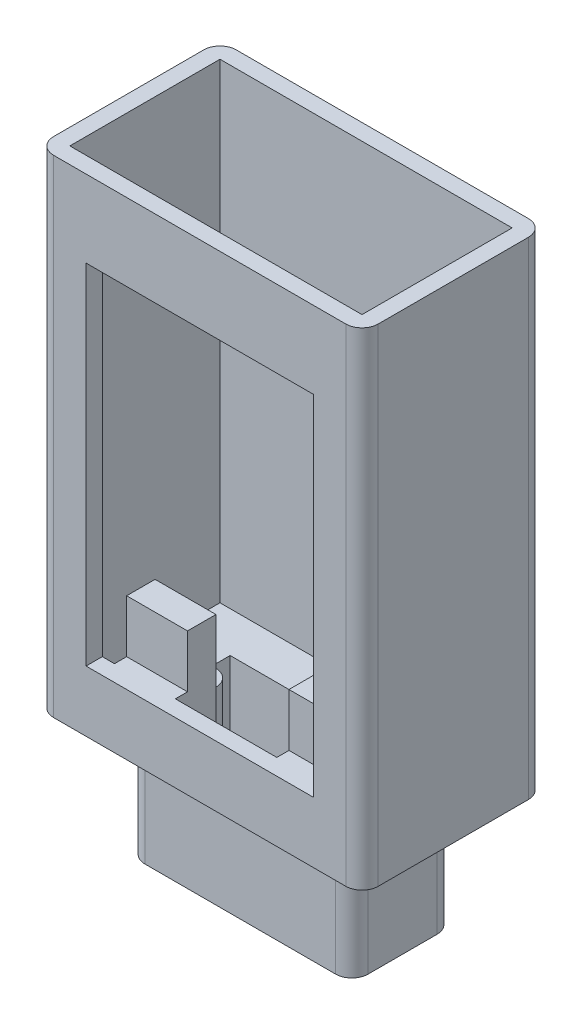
SolidWorks part; units mm, degrees
ref_plane "Ebene vorne" through (0, 0, 0) normal (0, 0, 1) x (1, 0, 0)
ref_plane "Ebene oben" through (0, 0, 0) normal (0, 1, 0) x (1, 0, 0)
ref_plane "Ebene rechts" through (0, 0, 0) normal (1, 0, 0) x (0, 0, -1)
sketch "Skizze1" plane through (0, 0, 0) normal (0, 1, 0) x (1, 0, 0)
  line L1 (40, -22.5) -> (-40, -22.5)
  line L2 (40, -22.5) -> (40, 22.5)
  line L3 (40, 22.5) -> (-40, 22.5)
  line L4 (-40, -22.5) -> (-40, 22.5)
  line L5 (40, -22.5) -> (-40, 22.5) construction
  line L6 (40, 22.5) -> (-40, -22.5) construction
  point P0 (0, 0)
  dimension "D1" = 45
  dimension "D2" = 80
extrude "Aufsatz-Linear austragen1" add sketch "Skizze1" along normal blind 120
sketch "Skizze6" plane through (0, 0, 0) normal (0, 0, 1) x (1, 0, 0)
  line L1 (-40, 120) -> (294.1001, 120)
  line L2 (-40, 120) -> (-40, 162.8242)
  line L3 (-40, 162.8242) -> (294.1001, 162.8242)
  line L4 (294.1001, 120) -> (294.1001, 162.8242)
extrude "Aufsatz-Linear austragen4" [suppressed] add sketch "Skizze6" along normal mid plane 45
sketch "Skizze7" plane through (0, 0, 0) normal (0, -1, 0) x (1, 0, 0)
  line L1 (27.5, -12.5) -> (-27.5, -12.5)
  line L2 (27.5, -12.5) -> (27.5, 12.5)
  line L3 (27.5, 12.5) -> (-27.5, 12.5)
  line L4 (-27.5, -12.5) -> (-27.5, 12.5)
  line L5 (27.5, -12.5) -> (-27.5, 12.5) construction
  line L6 (27.5, 12.5) -> (-27.5, -12.5) construction
  point P0 (0, 0)
  dimension "D1" = 25
  dimension "D2" = 55
extrude "Aufsatz-Linear austragen5" add sketch "Skizze7" along normal blind 30
fillet "Verrundung1" radius 4 4 edges at (27.5, -15, -12.5) (27.5, -15, 12.5) (-27.5, -15, -12.5) (-27.5, -15, 12.5)
shell "Wandung2" thickness 4
sketch "Skizze8" plane through (0, -30, 0) normal (0, -1, 0) x (1, 0, 0)
  line L0 (0, 0) -> (0, 6.0785) construction
  circle A0 centre (-22.5, 0) radius 4
  circle A1 centre (22.5, 0) radius 4
  dimension "D1" = 8
  dimension "D2" = 45
extrude "Aufsatz-Linear austragen6" add sketch "Skizze8" against normal up to surface (34 mm away)
sketch "Skizze9" plane through (0, -30, 0) normal (0, -1, 0) x (1, 0, 0)
  circle A0 centre (-22.5, 0) radius 1.5
  circle A1 centre (22.5, 0) radius 1.5
  dimension "D1" = 3
extrude "Schnitt-Linear austragen1" cut sketch "Skizze9" against normal through all
sketch "Skizze10" plane through (0, 0, 0) normal (0, 0, 1) x (1, 0, 0)
  line L0 (-40, 0) -> (40, 0) construction
  line L5 (-28, 15) -> (28, 15)
  line L6 (-28, 15) -> (-28, 101)
  line L7 (-28, 101) -> (28, 101)
  line L8 (28, 15) -> (28, 101)
  line L9 (-28, 15) -> (28, 101) construction
  line L10 (-28, 101) -> (28, 15) construction
  point P0 (0, 58)
  point P4 (79.6056, 3.9849)
  dimension "D1" = 56
  dimension "D2" = 86
  dimension "D3" = 15
extrude "Schnitt-Linear austragen2" cut sketch "Skizze10" along normal through all
sketch "Skizze11" plane through (0, 4, 0) normal (0, 1, 0) x (1, 0, 0)
  line L0 (23.5, -8.5) -> (-23.5, -8.5) construction
  line L1 (-25, -18.5) -> (-10, -18.5)
  line L2 (-25, -18.5) -> (-25, -8.5)
  line L3 (-25, -8.5) -> (-10, -8.5)
  line L4 (-10, -18.5) -> (-10, -8.5)
  line L5 (15, -18.5) -> (25, -18.5)
  line L6 (15, -18.5) -> (15, -8.5)
  line L7 (15, -8.5) -> (25, -8.5)
  line L8 (25, -18.5) -> (25, -8.5)
  point P8 (0, 0)
  dimension "D1" = 15
  dimension "D2" = 10
  dimension "D3" = 10
  dimension "D4" = 15
  dimension "D5" = 10
extrude "Aufsatz-Linear austragen7" add sketch "Skizze11" along normal blind 11
fillet "Verrundung2" radius 4 4 edges at (-40, 60, -22.5) (-40, 60, 22.5) (40, 60, -22.5) (40, 60, 22.5)
sketch "Skizze12" plane through (0, 15, 0) normal (0, 1, 0) x (1, 0, 0)
  line L0 (-10, -18.5) -> (-10, -8.5) construction
  line L1 (-25, -8.5) -> (-10, -8.5)
  line L2 (-25, -8.5) -> (-25, -15.5)
  line L3 (-25, -15.5) -> (-10, -15.5)
  line L4 (-10, -8.5) -> (-10, -15.5)
  line L5 (25, -18.5) -> (25, -8.5) construction
  line L6 (15, -8.5) -> (25, -8.5)
  line L7 (15, -8.5) -> (15, -15.5)
  line L8 (15, -15.5) -> (25, -15.5)
  line L9 (25, -8.5) -> (25, -15.5)
  line L10 (-36, -18.5) -> (36, -18.5) construction
  dimension "D1" = 3
extrude "Aufsatz-Linear austragen8" add sketch "Skizze12" along normal blind 13
